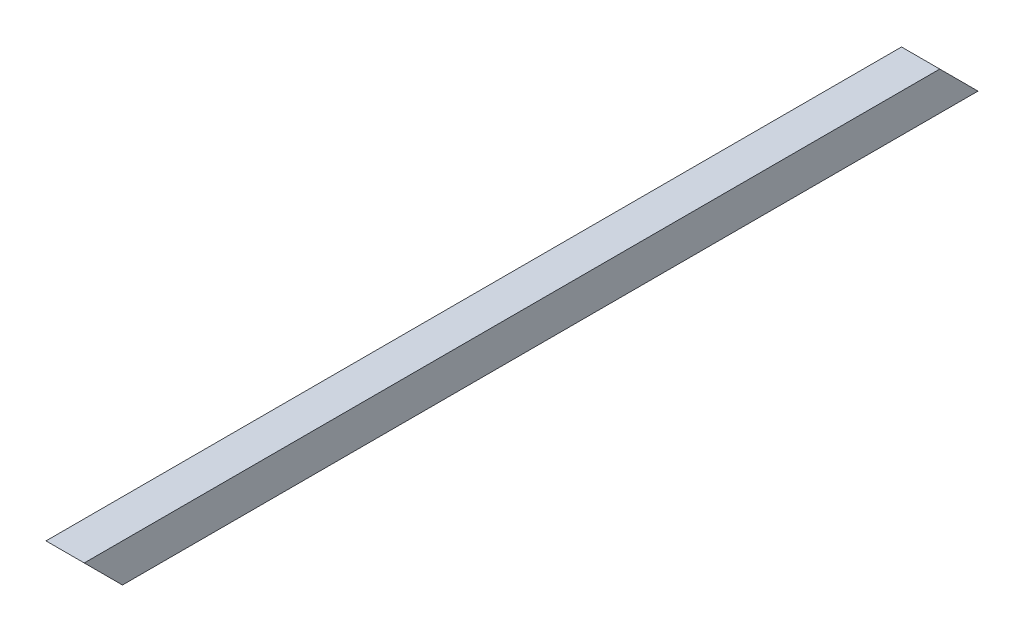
SolidWorks part; units mm, degrees
ref_plane "Plan de face" through (0, 0, 0) normal (0, 0, 1) x (1, 0, 0)
ref_plane "Plan de dessus" through (0, 0, 0) normal (0, 1, 0) x (1, 0, 0)
ref_plane "Plan de droite" through (0, 0, 0) normal (1, 0, 0) x (0, 0, -1)
sketch "Esquisse1" plane through (0, 0, 0) normal (0, 0, 1) x (1, 0, 0)
  line L1 (3, 77) -> (77, 77)
  line L2 (80, 80) -> (0, 80)
  line L3 (80, 80) -> (80, 0)
  line L4 (80, 0) -> (0, 0)
  line L5 (3, 77) -> (3, 3)
  line L6 (0, 80) -> (0, 0)
  line L7 (3, 3) -> (77, 3)
  line L8 (77, 77) -> (77, 3)
  dimension "D1" = 80
  dimension "D2" = 80
  dimension "D3" = 3
  dimension "D4" = 3
  dimension "D5" = 3
  dimension "D6" = 3
extrude "Extrusion1" add sketch "Esquisse1" along normal blind 1870
chamfer "Chanfrein1" distance 80 1 edges at (40, 0, 1870)
chamfer "Chanfrein2" distance 80 1 edges at (40, 80, 0)
